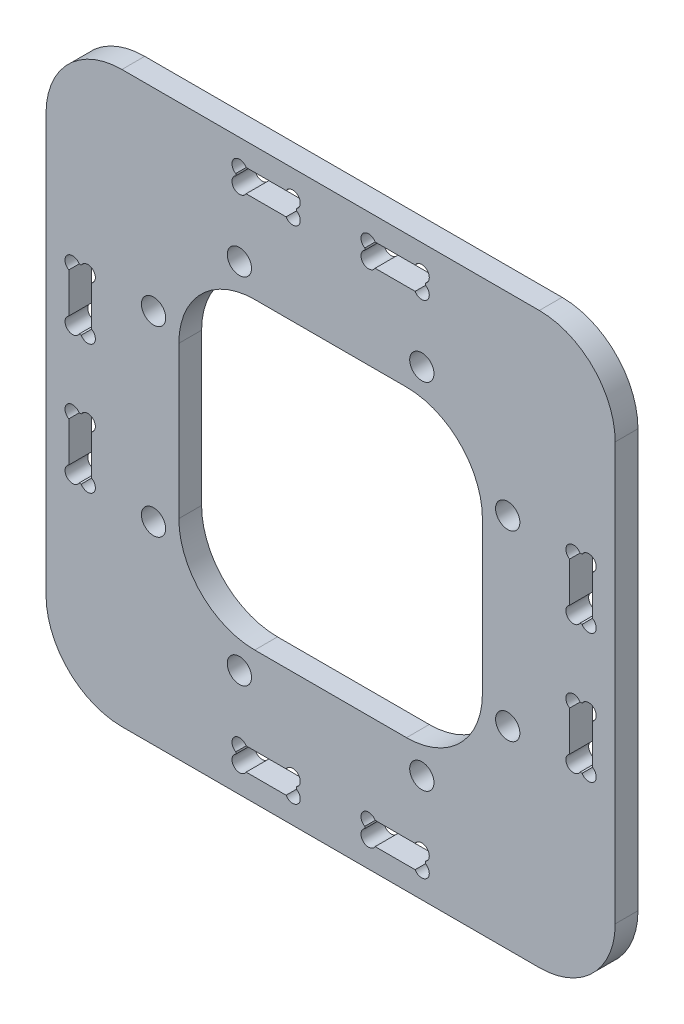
SolidWorks part; units mm, degrees
ref_plane "前视基准面" through (0, 0, 0) normal (0, 0, 1) x (1, 0, 0)
ref_plane "上视基准面" through (0, 0, 0) normal (0, 1, 0) x (1, 0, 0)
ref_plane "右视基准面" through (0, 0, 0) normal (1, 0, 0) x (0, 0, -1)
sketch "草图1" plane through (0, 0, 0) normal (0, 0, 1) x (1, 0, 0)
  line L1 (-20, -20) -> (20, -20)
  line L2 (-20, -20) -> (-20, 20)
  line L3 (-20, 20) -> (20, 20)
  line L4 (20, -20) -> (20, 20)
  line L5 (-20, -20) -> (20, 20) construction
  line L6 (-20, 20) -> (20, -20) construction
  line L7 (-37.5, -37.5) -> (37.5, -37.5)
  line L8 (-37.5, -37.5) -> (-37.5, 37.5)
  line L9 (-37.5, 37.5) -> (37.5, 37.5)
  line L10 (37.5, -37.5) -> (37.5, 37.5)
  line L11 (-37.5, -37.5) -> (37.5, 37.5) construction
  line L12 (-37.5, 37.5) -> (37.5, -37.5) construction
  point P0 (0, 0)
  point P6 (0, 0)
  point P11 (22.2077, 31.2532)
  dimension "D1" = 75
  dimension "D2" = 75
  dimension "D3" = 40
  dimension "D4" = 40
extrude "凸台-拉伸1" add sketch "草图1" along normal blind 3
hole_wizard "Ø3.2 (3.2) 直径孔1" positions "草图2" profile "草图3" hole size "Ø3.2" standard "GB"
sketch "草图2" plane through (0, 0, 3) normal (0, 0, 1) x (1, 0, 0)
  line L0 (37.5, 37.5) -> (-37.5, -37.5) construction
  line L2 (-37.5, 0) -> (37.5, 0) construction
  line L3 (-37.5, 37.5) -> (-37.5, -37.5) construction
  line L4 (37.5, -37.5) -> (37.5, 37.5) construction
  line L6 (0, 37.5) -> (0, -37.5) construction
  line L7 (37.5, 37.5) -> (-37.5, 37.5) construction
  line L8 (-37.5, -37.5) -> (37.5, -37.5) construction
  line L9 (-37.5, 37.5) -> (37.5, -37.5) construction
  point P22 (-23.3345, -12.0208)
  point P31 (0, 0)
  point P32 (-12.0208, -23.3345)
  point P33 (12.0208, -23.3345)
  point P34 (23.3345, -12.0208)
  point P35 (23.3345, 12.0208)
  point P36 (12.0208, 23.3345)
  point P37 (-12.0208, 23.3345)
  point P38 (-23.3345, 12.0208)
  dimension "D1" = 16
  dimension "D2" = 50
sketch "草图3" plane through (-23.3345, 12.0208, 3) normal (1, 0, 0) x (0, -1, 0)
  line L0 (0, 0) -> (0, 3)
  line L1 (0, 3) -> (1.6, 3)
  line L2 (1.6, 3) -> (1.6, 0)
  line L5 (1.6, 0) -> (0, 0)
  line L11 (0, -6.35) -> (0, 107.95) construction
  dimension "通孔孔直径" = 3.2
  dimension "通孔孔深度" = 3
sketch "草图4" plane through (0, 0, 3) normal (0, 0, 1) x (1, 0, 0)
  line L0 (0, 37.5) -> (0, -37.5) construction
  line L1 (37.5, 37.5) -> (-37.5, 37.5) construction
  line L2 (-37.5, -37.5) -> (37.5, -37.5) construction
  line L3 (-37.5, 0) -> (37.5, 0) construction
  line L4 (-12.5, 34.5) -> (-4.5, 34.5)
  line L5 (-12.5, 34.5) -> (-12.5, 31.5)
  line L6 (-12.5, 31.5) -> (-4.5, 31.5)
  line L7 (-4.5, 34.5) -> (-4.5, 31.5)
  line L8 (-37.5, 37.5) -> (-37.5, -37.5) construction
  line L9 (37.5, -37.5) -> (37.5, 37.5) construction
  line L10 (4.5, 34.5) -> (4.5, 31.5)
  line L11 (12.5, 31.5) -> (4.5, 31.5)
  line L12 (12.5, 34.5) -> (12.5, 31.5)
  line L13 (12.5, 34.5) -> (4.5, 34.5)
  line L14 (0, 0) -> (37.5, 37.5) construction
  line L15 (34.5, 12.5) -> (34.5, 4.5)
  line L16 (34.5, 12.5) -> (31.5, 12.5)
  line L17 (31.5, 12.5) -> (31.5, 4.5)
  line L18 (34.5, 4.5) -> (31.5, 4.5)
  line L19 (34.5, -4.5) -> (31.5, -4.5)
  line L20 (31.5, -12.5) -> (31.5, -4.5)
  line L21 (34.5, -12.5) -> (31.5, -12.5)
  line L22 (34.5, -12.5) -> (34.5, -4.5)
  line L23 (-34.5, -12.5) -> (-34.5, -4.5)
  line L24 (-34.5, -12.5) -> (-31.5, -12.5)
  line L25 (-31.5, -12.5) -> (-31.5, -4.5)
  line L26 (-34.5, -4.5) -> (-31.5, -4.5)
  line L27 (-34.5, 4.5) -> (-31.5, 4.5)
  line L28 (-31.5, 12.5) -> (-31.5, 4.5)
  line L29 (-34.5, 12.5) -> (-31.5, 12.5)
  line L30 (-34.5, 12.5) -> (-34.5, 4.5)
  line L31 (12.5, -34.5) -> (4.5, -34.5)
  line L32 (12.5, -34.5) -> (12.5, -31.5)
  line L33 (12.5, -31.5) -> (4.5, -31.5)
  line L34 (4.5, -34.5) -> (4.5, -31.5)
  line L35 (-4.5, -34.5) -> (-4.5, -31.5)
  line L36 (-12.5, -31.5) -> (-4.5, -31.5)
  line L37 (-12.5, -34.5) -> (-12.5, -31.5)
  line L38 (-12.5, -34.5) -> (-4.5, -34.5)
  dimension "D1" = 25
  dimension "D2" = 9
  dimension "D3" = 69
  dimension "D4" = 3
extrude "切除-拉伸1" cut sketch "草图4" against normal blind 3
hole_wizard "Ø2.0 (2) 直径孔1" positions "草图5" profile "草图6" hole size "Ø2.0" standard "GB"
sketch "草图5" plane through (0, 0, 3) normal (0, 0, 1) x (1, 0, 0)
  line L0 (-31.5, 12.5) -> (-34.5, 12.5) construction
  line L1 (-34.5, 12.5) -> (-34.5, 4.5) construction
  line L2 (-33, 12.5) -> (-33, 4.5) construction
  line L3 (-34.5, 4.5) -> (-31.5, 4.5) construction
  line L5 (-34.5, 8.5) -> (-31.5, 8.5) construction
  line L6 (-31.5, 4.5) -> (-31.5, 12.5) construction
  line L8 (-37.5, 0) -> (37.5, 0) construction
  line L9 (-37.5, 37.5) -> (-37.5, -37.5) construction
  line L10 (37.5, -37.5) -> (37.5, 37.5) construction
  line L12 (0, 0) -> (37.5, 37.5) construction
  point P2 (-34, 12)
  point P15 (-32, 12)
  point P21 (-32, 5)
  point P22 (-34, 5)
  point P34 (-34, -5)
  point P35 (-32, -5)
  point P36 (-32, -12)
  point P37 (-34, -12)
  point P38 (-12, -34)
  point P39 (-12, -32)
  point P40 (-5, -32)
  point P41 (-5, -34)
  point P42 (5, -34)
  point P43 (5, -32)
  point P44 (12, -32)
  point P45 (12, -34)
  point P46 (12, 34)
  point P47 (12, 32)
  point P48 (5, 32)
  point P49 (5, 34)
  point P50 (-5, 34)
  point P51 (-5, 32)
  point P52 (-12, 32)
  point P53 (-12, 34)
  point P54 (34, -12)
  point P55 (32, -12)
  point P56 (32, -5)
  point P57 (34, -5)
  point P58 (34, 5)
  point P59 (32, 5)
  point P60 (32, 12)
  point P61 (34, 12)
  dimension "D1" = 0.5
  dimension "D2" = 0.5
sketch "草图6" plane through (-34, 12, 3) normal (1, 0, 0) x (0, -1, 0)
  line L0 (0, 0) -> (0, 3)
  line L1 (0, 3) -> (1, 3)
  line L2 (1, 3) -> (1, 0)
  line L5 (1, 0) -> (0, 0)
  line L11 (0, -6.35) -> (0, 107.95) construction
  dimension "通孔孔直径" = 2
  dimension "通孔孔深度" = 3
fillet "圆角1" radius 10 8 edges at (-37.5, 37.5, 1.5) (37.5, 37.5, 1.5) (37.5, -37.5, 1.5) (-37.5, -37.5, 1.5) (-20, -20, 1.5) (20, -20, 1.5) (20, 20, 1.5) (-20, 20, 1.5)
